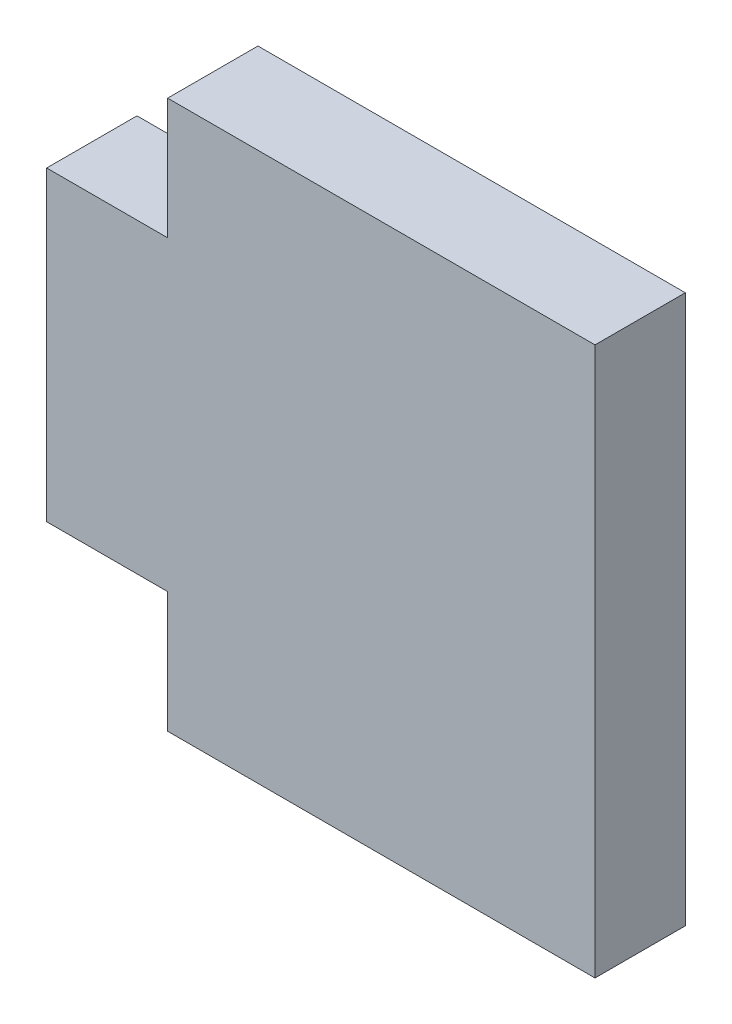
SolidWorks part; units mm, degrees
ref_plane "Front Plane" through (0, 0, 0) normal (0, 0, 1) x (1, 0, 0)
ref_plane "Top Plane" through (0, 0, 0) normal (0, 1, 0) x (1, 0, 0)
ref_plane "Right Plane" through (0, 0, 0) normal (1, 0, 0) x (0, 0, -1)
sketch "Sketch1" plane through (0, 0, 0) normal (0, 0, 1) x (1, 0, 0)
  line L1 (0, 0) -> (43.18, 0)
  line L2 (0, 0) -> (0, 43.18)
  line L3 (0, 43.18) -> (43.18, 43.18)
  line L4 (43.18, 0) -> (43.18, 43.18)
  dimension "D1" = 43.18
  dimension "D2" = 43.18
extrude "Boss-Extrude1" add sketch "Sketch1" along normal blind 7.112
sketch "Sketch2" plane through (0, 0, 7.112) normal (0, 0, 1) x (1, 0, 0)
  line L1 (0, 43.18) -> (9.525, 43.18)
  line L2 (0, 43.18) -> (0, 33.655)
  line L3 (0, 33.655) -> (9.525, 33.655)
  line L4 (9.525, 43.18) -> (9.525, 33.655)
  line L9 (0, 0) -> (9.525, 0)
  line L10 (0, 0) -> (0, 9.525)
  line L11 (0, 9.525) -> (9.525, 9.525)
  line L12 (9.525, 0) -> (9.525, 9.525)
  dimension "D1" = 9.525
  dimension "D2" = 9.525
  dimension "D3" = 9.525
  dimension "D4" = 9.525
extrude "Cut-Extrude1" cut sketch "Sketch2" against normal blind 18.796
